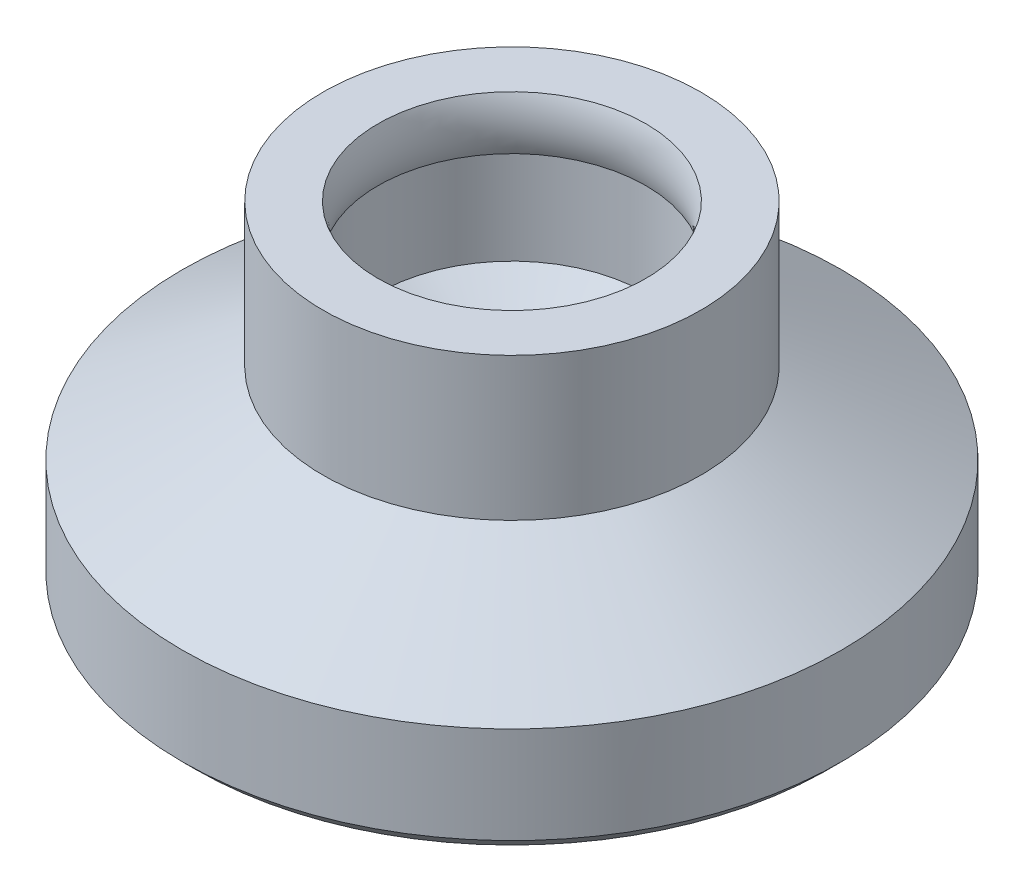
SolidWorks part; units mm, degrees
ref_plane "Front Plane" through (0, 0, 0) normal (0, 0, 1) x (1, 0, 0)
ref_plane "Top Plane" through (0, 0, 0) normal (0, 1, 0) x (1, 0, 0)
ref_plane "Right Plane" through (0, 0, 0) normal (1, 0, 0) x (0, 0, -1)
sketch "Sketch1" plane through (0, 0, 0) normal (0, 1, 0) x (1, 0, 0)
  circle A0 centre (0, 0) radius 4.3
  dimension "D1" = 8.6
extrude "Extrude1" add sketch "Sketch1" along normal mid plane 7.6
sketch "Sketch3" plane through (0, -3.8, 0) normal (0, -1, 0) x (1, 0, 0)
  circle A0 centre (0, 0) radius 7.5
  dimension "D1" = 15
extrude "Extrude2" add sketch "Sketch3" against normal blind 2.5
sketch "Sketch4" plane through (0, 0, 0) normal (0, 0, 1) x (1, 0, 0)
  line L0 (-7.5, -1.3) -> (-4.3, 0.5475)
  line L1 (-4.3, 3.8) -> (-4.3, -1.3) construction
  line L2 (-4.3, 0.5475) -> (-4.3, -1.3)
  line L3 (-4.3, -1.3) -> (-7.5, -1.3)
  dimension "D1" = 30
revolve "Revolve1" add sketch "Sketch4" angle 360 about axis through (0, 3.8, 0) along (0, -1, 0)
chamfer "Chamfer1" distance 0.3 angle 45 1 edges at (0, -3.8, -7.5)
sketch "Sketch5" plane through (0, 0, 0) normal (0, 0, 1) x (1, 0, 0)
  line L1 (0, 0) -> (0, 11.3083) construction
  line L2 (0, 3.8) -> (3.05, 3.8)
  line L3 (4.3, 3.8) -> (-4.3, 3.8) construction
  line L4 (3.05, 2.58) -> (3.05, 0.4609)
  line L5 (3.05, 0.4609) -> (0, -1.3)
  line L6 (0, -1.3) -> (0, 3.8)
  line L7 (7.5, -1.3) -> (-7.5, -1.3) construction
  arc A0 (3.05, 3.8) -> (3.05, 2.58) centre (4.514, 3.19) ccw
  point P14 (2.928, 3.19)
  dimension "D2" = 6.1
  dimension "D1" = 60
  dimension "D3" = 1.22
  dimension "D4" = 0.122
revolve "Cut-Revolve1" cut sketch "Sketch5" angle 360 about L1
equation "\"D3@Sketch5\" = \"D2@Sketch5\"*0.2"
equation "\"D4@Sketch5\" = \"D3@Sketch5\"*0.1"
